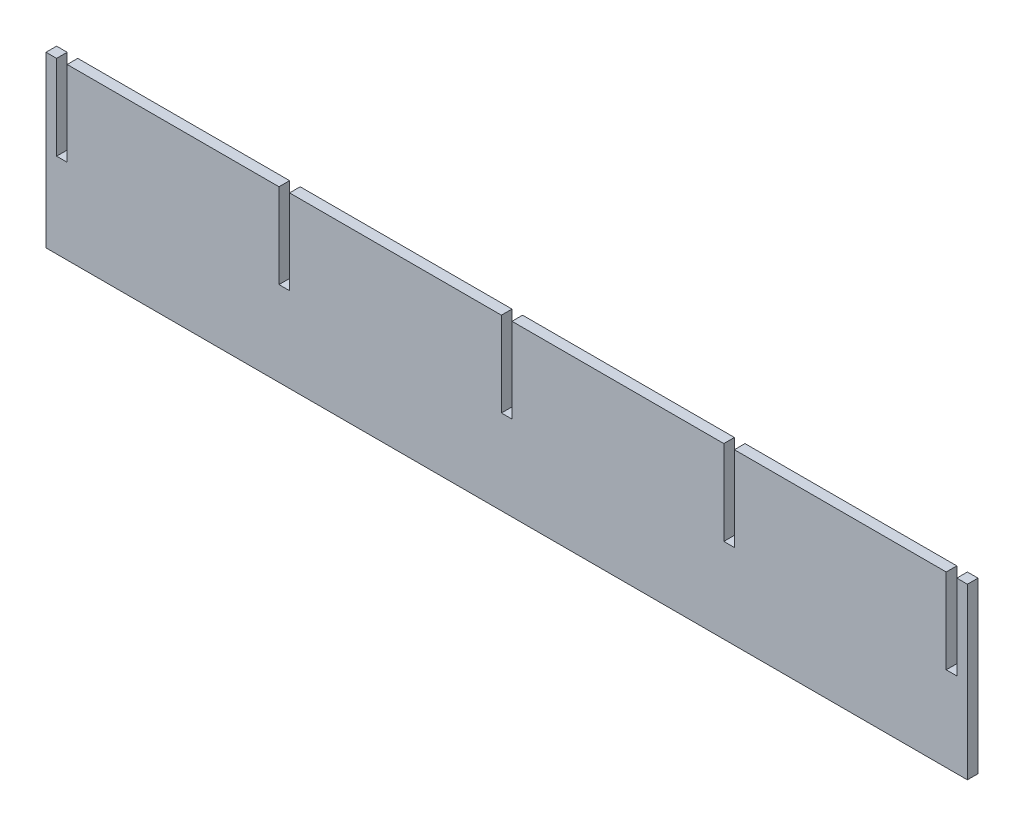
SolidWorks part; units mm, degrees
ref_plane "Front Plane" through (0, 0, 0) normal (0, 0, 1) x (1, 0, 0)
ref_plane "Top Plane" through (0, 0, 0) normal (0, 1, 0) x (1, 0, 0)
ref_plane "Right Plane" through (0, 0, 0) normal (1, 0, 0) x (0, 0, -1)
sketch "Sketch1" plane through (0, 0, 0) normal (0, 0, 1) x (1, 0, 0)
  line L0 (431.8, 0) -> (431.8, 101.6)
  line L1 (431.8, 101.6) -> (438.15, 101.6)
  line L2 (438.15, 101.6) -> (438.15, 50.8)
  line L3 (438.15, 50.8) -> (444.5, 50.8)
  line L4 (444.5, 50.8) -> (444.5, 101.6)
  line L5 (704.85, 101.6) -> (704.85, 50.8)
  line L6 (704.85, 50.8) -> (711.2, 50.8)
  line L7 (711.2, 50.8) -> (711.2, 101.6)
  line L8 (711.2, 101.6) -> (838.2, 101.6)
  line L9 (838.2, 101.6) -> (838.2, 50.8)
  line L10 (838.2, 50.8) -> (844.55, 50.8)
  line L11 (844.55, 50.8) -> (844.55, 101.6)
  line L12 (844.55, 101.6) -> (971.55, 101.6)
  line L13 (971.55, 101.6) -> (971.55, 50.8)
  line L14 (971.55, 50.8) -> (977.9, 50.8)
  line L15 (977.9, 50.8) -> (977.9, 101.6)
  line L16 (977.9, 101.6) -> (984.25, 101.6)
  line L17 (984.25, 101.6) -> (984.25, 0)
  line L18 (984.25, 0) -> (431.8, 0)
  line L20 (444.5, 101.6) -> (571.5, 101.6)
  line L21 (571.5, 101.6) -> (571.5, 50.8)
  line L22 (571.5, 50.8) -> (577.85, 50.8)
  line L23 (577.85, 50.8) -> (577.85, 101.6)
  line L24 (577.85, 101.6) -> (704.85, 101.6)
extrude "Boss-Extrude1" add sketch "Sketch1" along normal blind 6.35
